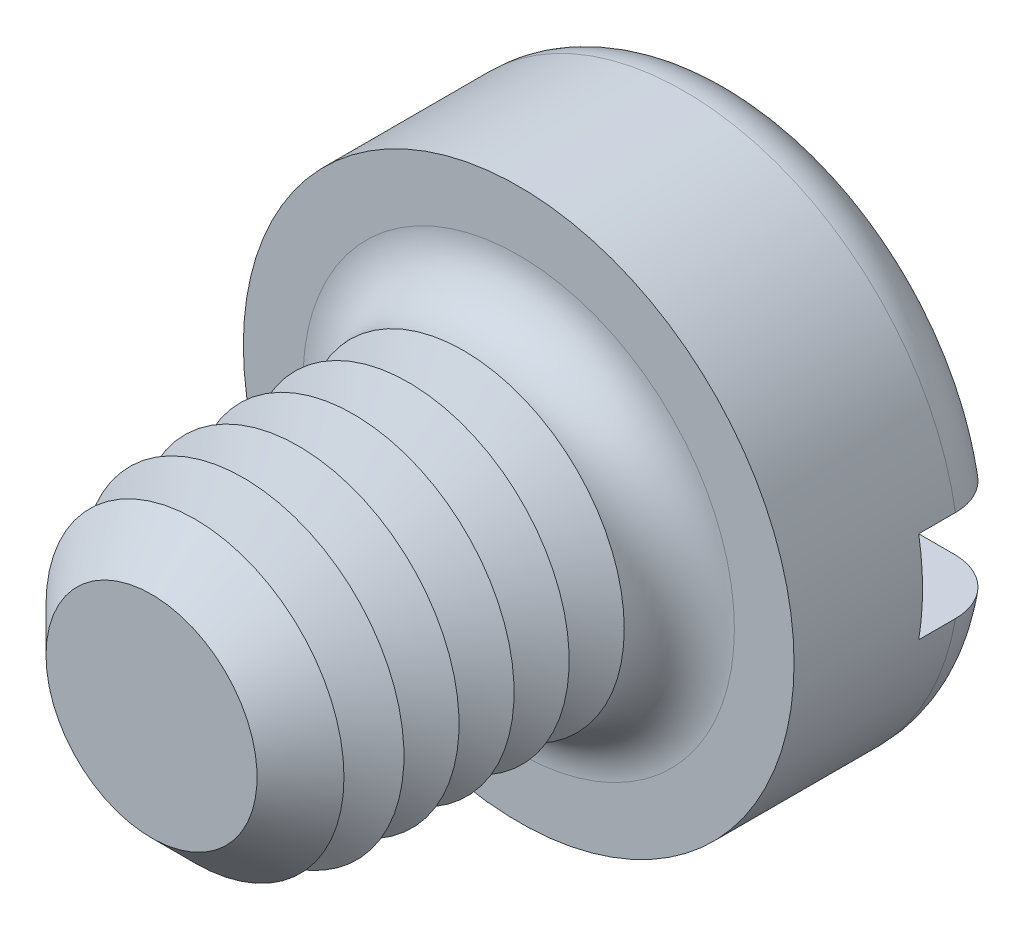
SolidWorks part; units mm, degrees
ref_plane "Front Plane" through (0, 0, 0) normal (0, 0, 1) x (1, 0, 0)
ref_plane "Top Plane" through (0, 0, 0) normal (0, 1, 0) x (1, 0, 0)
ref_plane "Right Plane" through (0, 0, 0) normal (1, 0, 0) x (0, 0, -1)
sketch "Sketch3" plane through (0, 0, 0) normal (0, 0, 1) x (1, 0, 0)
  circle A0 centre (0, 0) radius 3
  dimension "D1" = 6
extrude "Boss-Extrude2" add sketch "Sketch3" against normal blind 2.4
sketch "Sketch4" plane through (0, 0, 0) normal (0, 0, 1) x (1, 0, 0)
  circle A0 centre (0, 0) radius 1.75
  dimension "D1" = 3.5
extrude "Boss-Extrude3" add sketch "Sketch4" along normal blind 4
fillet "Fillet1" radius 0.6 2 edges at (3, 0, -2.4) (1.75, 0, 0)
chamfer "Chamfer1" distance 0.6 angle 45 1 edges at (1.75, 0, 4)
sketch "Sketch5" plane through (0, 0, 0) normal (1, 0, 0) x (0, 0, -1)
  line L0 (1.6944, 0) -> (-7.6738, 0) construction
sketch "Sketch6" plane through (0, 0, 0) normal (1, 0, 0) x (0, 0, -1)
  line L0 (-0.6, 1.75) -> (-0.9, 1.2304)
  line L1 (-0.9, 1.2304) -> (-1.2, 1.75)
  line L2 (-0.6, 1.75) -> (-3.4, 1.75) construction
  line L3 (-1.2, 1.75) -> (-0.6, 1.75)
  dimension "D1" = 0.6
revolve "Cut-Revolve1" cut sketch "Sketch6" angle 360 about L0
pattern_linear "LPattern1" count 5 spacing 0.6 along (0, 0, 1) of "Cut-Revolve1"
sketch "Sketch8" plane through (0, 0, -2.4) normal (0, 0, -1) x (-1, 0, 0)
  line L1 (3, -0.5) -> (-3, -0.5)
  line L2 (3, -0.5) -> (3, 0.5)
  line L3 (3, 0.5) -> (-3, 0.5)
  line L4 (-3, -0.5) -> (-3, 0.5)
  line L5 (3, -0.5) -> (-3, 0.5) construction
  line L6 (3, 0.5) -> (-3, -0.5) construction
  point P0 (0, 0)
  dimension "D1" = 6
  dimension "D2" = 1
extrude "Cut-Extrude1" cut sketch "Sketch8" against normal blind 1
